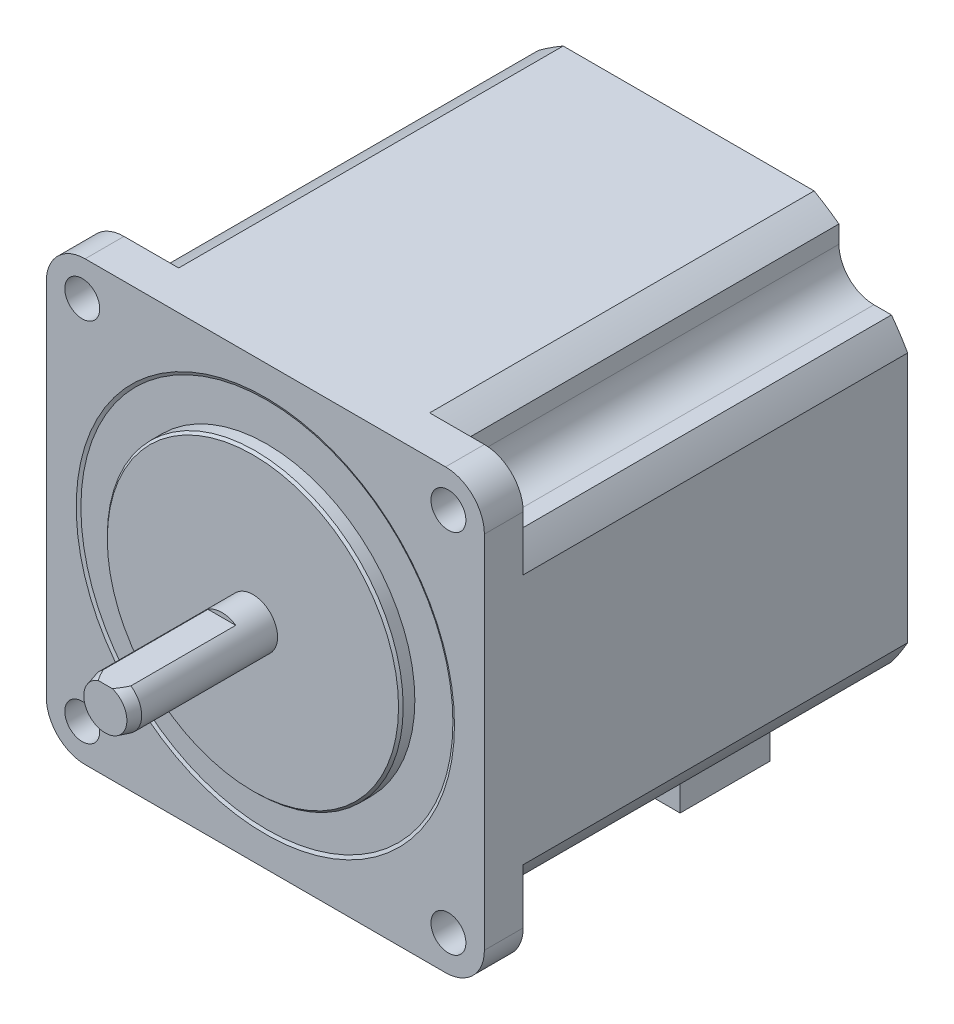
SolidWorks part; units mm, degrees
ref_plane "正面" through (0, 0, 0) normal (0, 0, 1) x (1, 0, 0)
ref_plane "平面" through (0, 0, 0) normal (0, 1, 0) x (1, 0, 0)
ref_plane "右側面" through (0, 0, 0) normal (1, 0, 0) x (0, 0, -1)
sketch "ｽｹｯﾁ1" plane through (0, 0, 0) normal (0, 0, 1) x (1, 0, 0)
  circle A0 centre (0, 0) radius 3.175
  dimension "D1" = 6.35
extrude "押し出し1" add sketch "ｽｹｯﾁ1" along normal blind 19
sketch "ｽｹｯﾁ2" plane through (0, 0, 0) normal (0, 0, -1) x (-1, 0, 0)
  circle A0 centre (0, 0) radius 19.05
  dimension "D1" = 38.1
extrude "押し出し2" add sketch "ｽｹｯﾁ2" along normal blind 1.6
sketch "ｽｹｯﾁ3" plane through (0, 0, -1.6) normal (0, 0, -1) x (-1, 0, 0)
  line L1 (-28.2, 28.2) -> (28.2, 28.2)
  line L2 (-28.2, 28.2) -> (-28.2, -28.2)
  line L3 (-28.2, -28.2) -> (28.2, -28.2)
  line L4 (28.2, 28.2) -> (28.2, -28.2)
  line L5 (-28.2, 28.2) -> (28.2, -28.2) construction
  line L6 (-28.2, -28.2) -> (28.2, 28.2) construction
  line L7 (23.57, 23.57) -> (-23.57, 23.57) construction
  line L8 (23.57, 23.57) -> (23.57, -23.57) construction
  line L9 (23.57, -23.57) -> (-23.57, -23.57) construction
  line L10 (-23.57, 23.57) -> (-23.57, -23.57) construction
  line L11 (23.57, 23.57) -> (-23.57, -23.57) construction
  line L12 (23.57, -23.57) -> (-23.57, 23.57) construction
  circle A0 centre (23.57, 23.57) radius 2.25
  circle A1 centre (-23.57, 23.57) radius 2.25
  circle A2 centre (23.57, -23.57) radius 2.25
  circle A3 centre (-23.57, -23.57) radius 2.25
  point P0 (0, 0)
  point P6 (0, 0)
  dimension "D3" = 47.14
  dimension "D4" = 47.14
  dimension "D6" = 4.5
  dimension "D1" = 56.4
  dimension "D2" = 56.4
extrude "押し出し3" add sketch "ｽｹｯﾁ3" along normal blind 5
fillet "Fillet1" radius 5 4 edges at (28.2, -28.2, -4.1) (-28.2, -28.2, -4.1) (-28.2, 28.2, -4.1) (28.2, 28.2, -4.1)
sketch "ｽｹｯﾁ4" plane through (0, 0, -6.6) normal (0, 0, -1) x (-1, 0, 0)
  line L0 (19.35, 19.35) -> (28.2, 19.35)
  line L1 (-19.35, 28.2) -> (19.35, 28.2)
  line L2 (-19.35, 28.2) -> (-19.35, 19.35)
  line L3 (-19.35, -28.2) -> (19.35, -28.2)
  line L4 (19.35, 28.2) -> (19.35, 19.35)
  line L5 (-19.35, 28.2) -> (19.35, -28.2) construction
  line L6 (-19.35, -28.2) -> (19.35, 28.2) construction
  line L7 (-28.2, 19.35) -> (-19.35, 19.35)
  line L8 (-28.2, 19.35) -> (-28.2, -19.35)
  line L9 (-28.2, -19.35) -> (-19.35, -19.35)
  line L10 (28.2, 19.35) -> (28.2, -19.35)
  line L11 (-28.2, 19.35) -> (28.2, -19.35) construction
  line L12 (-28.2, -19.35) -> (28.2, 19.35) construction
  line L13 (-19.35, -19.35) -> (-19.35, -28.2)
  line L14 (19.35, -19.35) -> (28.2, -19.35)
  line L15 (19.35, -19.35) -> (19.35, -28.2)
  circle A0 centre (0, 0) radius 32.5
  point P0 (0, 0)
  point P6 (0, 0)
  dimension "D5" = 65
  dimension "D1" = 38.7
  dimension "D2" = 56.4
  dimension "D3" = 56.4
  dimension "D4" = 38.7
extrude "押し出し4" add sketch "ｽｹｯﾁ4" along normal blind 49.5 contours L10 A0 L0 L4 L1 L2 L7 L8 L9 L13 L3 L15 L14
fillet "Fillet2" radius 4.5 4 edges at (19.35, -19.35, -31.35) (-19.35, -19.35, -31.35) (-19.35, 19.35, -31.35) (19.35, 19.35, -31.35)
sketch "Sketch1" plane through (0, -28.2, 0) normal (0, -1, 0) x (1, 0, 0)
  line L0 (16.1558, -56.1) -> (-16.1558, -56.1) construction
  line L1 (-10.5, -56.1) -> (10.5, -56.1)
  line L2 (-10.5, -56.1) -> (-10.5, -44.5)
  line L3 (-10.5, -44.5) -> (10.5, -44.5)
  line L4 (10.5, -56.1) -> (10.5, -44.5)
  dimension "D1" = 11.6
  dimension "D2" = 21
  dimension "D3" = 10.5
extrude "Extrude1" add sketch "Sketch1" along normal blind 10
chamfer "Chamfer5" distance 1.5 angle 15 1 edges at (3.175, 0, 19)
sketch "Sketch2" plane through (0, 0, 19) normal (0, 0, 1) x (1, 0, 0)
  line L1 (-4.7278, 5.1185) -> (3.4221, 5.1185)
  line L2 (-4.7278, 5.1185) -> (-4.7278, 2.625)
  line L3 (-4.7278, 2.625) -> (3.4221, 2.625)
  line L4 (3.4221, 5.1185) -> (3.4221, 2.625)
  dimension "D1" = 2.625
extrude "Extrude2" cut sketch "Sketch2" against normal blind 15
sketch "Sketch6" plane through (0, 0, -1.6) normal (0, 0, 1) x (1, 0, 0)
  circle A0 centre (0, 0) radius 19.05
  circle A1 centre (0, 0) radius 24.35
  dimension "D1" = 48.7
  dimension "D2" = 38.1
extrude "Extrude6" cut sketch "Sketch6" against normal blind 0.2
chamfer "Chamfer6" distance 0.2 distance2 0.4 1 edges at (24.35, 0, -1.8)
chamfer "Chamfer2" distance 0.3 angle 45 1 edges at (-19.05, 0, 0)
